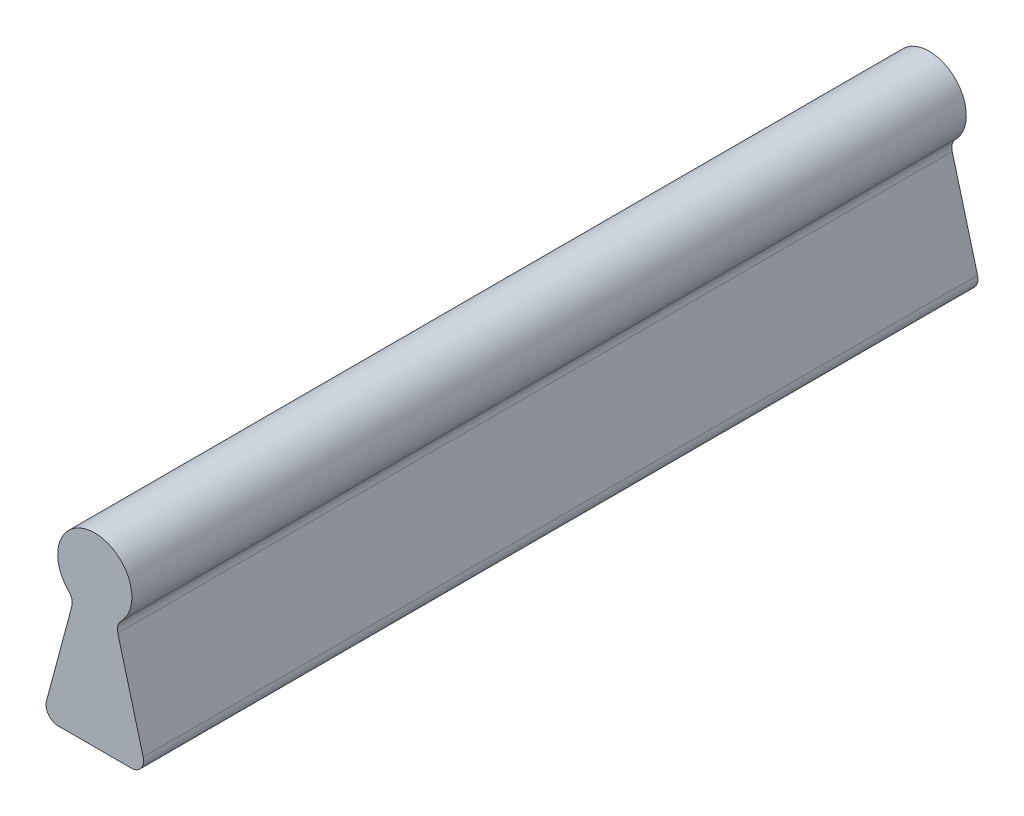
SolidWorks part; units mm, degrees
ref_plane "Plan de face" through (0, 0, 0) normal (0, 0, 1) x (1, 0, 0)
ref_plane "Plan de dessus" through (0, 0, 0) normal (0, 1, 0) x (1, 0, 0)
ref_plane "Plan de droite" through (0, 0, 0) normal (1, 0, 0) x (0, 0, -1)
sketch "Esquisse1" plane through (0, 0, 0) normal (0, 0, 1) x (1, 0, 0)
  line L0 (25.4134, -5.7412) -> (23.3625, 1.9128) construction
  line L1 (18.5526, -7) -> (24.4474, -7) construction
  line L2 (19.6375, 1.9128) -> (17.5866, -5.7412) construction
  line L3 (25.4134, -5.7412) -> (23.3625, 1.9128)
  line L4 (18.5526, -7) -> (24.4474, -7)
  line L5 (19.6375, 1.9128) -> (17.5866, -5.7412)
  arc A0 (24.4474, -7) -> (25.4134, -5.7412) centre (24.4474, -6) ccw construction
  arc A1 (17.5866, -5.7412) -> (18.5526, -7) centre (18.5526, -6) ccw construction
  arc A2 (19.6375, 1.9128) -> (19.3787, 2.8787) centre (18.6716, 2.1716) ccw construction
  arc A3 (23.6213, 2.8787) -> (19.3787, 2.8787) centre (21.5, 5) ccw construction
  arc A4 (23.6213, 2.8787) -> (23.3625, 1.9128) centre (24.3284, 2.1716) ccw construction
  arc A5 (24.4474, -7) -> (25.4134, -5.7412) centre (24.4474, -6) ccw
  arc A6 (17.5866, -5.7412) -> (18.5526, -7) centre (18.5526, -6) ccw
  arc A7 (19.6375, 1.9128) -> (19.3787, 2.8787) centre (18.6716, 2.1716) ccw
  arc A8 (23.6213, 2.8787) -> (19.3787, 2.8787) centre (21.5, 5) ccw
  arc A9 (23.6213, 2.8787) -> (23.3625, 1.9128) centre (24.3284, 2.1716) ccw
extrude "Boss.-Extru.1" add sketch "Esquisse1" along normal up to surface (67.5 mm away)
